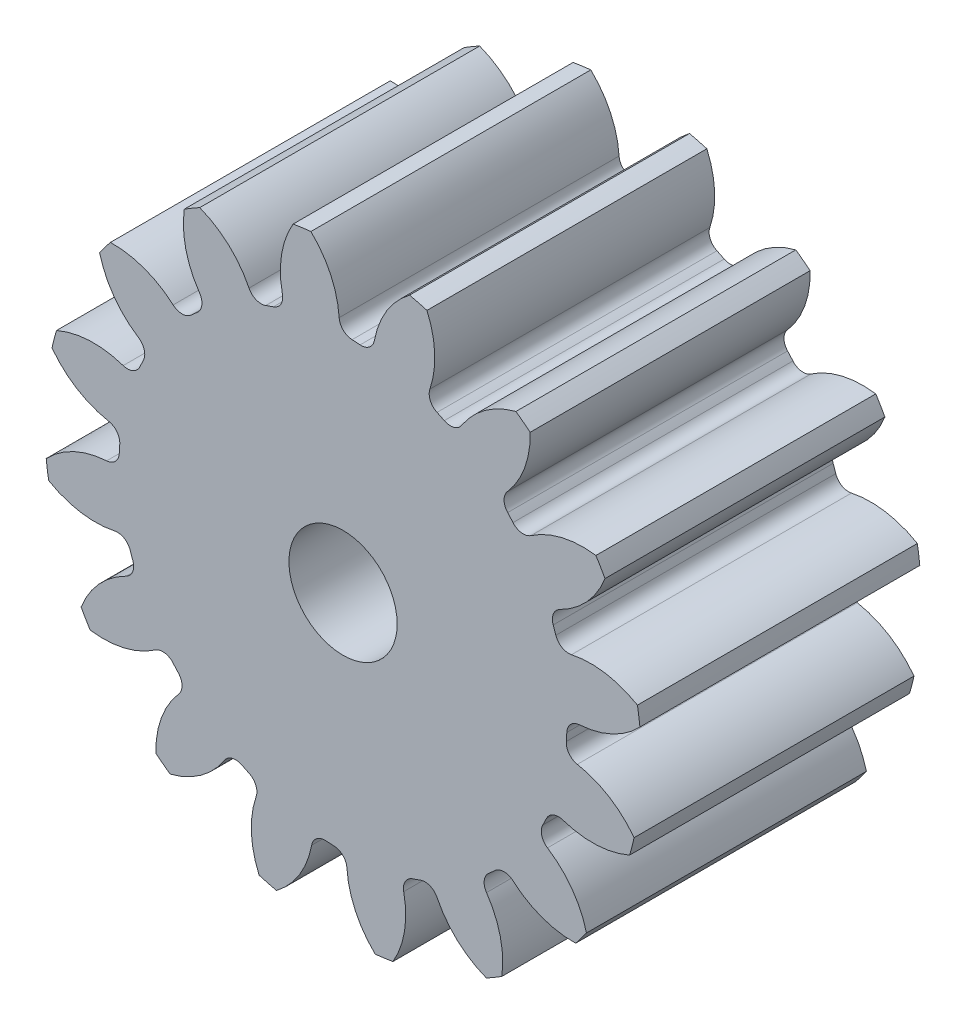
SolidWorks part; units mm, degrees
ref_plane "Front" through (0, 0, 0) normal (0, 0, 1) x (1, 0, 0)
ref_plane "Top" through (0, 0, 0) normal (0, 1, 0) x (1, 0, 0)
ref_plane "Right" through (0, 0, 0) normal (1, 0, 0) x (0, 0, -1)
sketch "Sketch3" plane through (0, 0, 0) normal (0, 0, 1) x (1, 0, 0)
  circle A0 centre (0, 0) radius 101.6
  dimension "od" = 203.2
extrude "gearBody" add sketch "Sketch3" along normal blind 95.25
sketch "Sketch2" plane through (0, 0, 0) normal (0, 0, 1) x (1, 0, 0)
  line L0 (0, 0) -> (78.4047, 32.4763) construction
  line L1 (99.5583, -23.3383) -> (0, 0) construction
  line L2 (0, 0) -> (36.3143, 0) construction
  line L3 (90.24, 3.5827) -> (89.2073, -14.077) construction
  line L5 (89.7236, -5.2472) -> (0, 0) construction
  line L7 (0, 0) -> (84.8647, 0) construction
  arc A0 (84.8429, 1.9236) -> (84.0403, -11.8002) centre (0, 0) ccw construction
  arc A1 (101.0096, 10.9371) -> (99.0461, -22.6367) centre (0, 0) ccw construction
  arc A2 (90.24, 3.5827) -> (89.2073, -14.077) centre (0, 0) ccw construction
  arc A3 (75.9778, -5.8153) -> (76.1377, -3.0807) centre (0, 0) ccw
  arc A4 (99.5583, -23.3383) -> (79.7285, -10.6848) centre (74.0847, -41.3941) ccw
  arc A5 (99.5583, -23.3383) -> (101.6, 11.5743) centre (0, 0) ccw
  arc A6 (101.6, 11.5743) -> (80.4304, 1.3185) centre (78.4047, 32.4763) cw
  arc A7 (76.1377, -3.0807) -> (80.4304, 1.3185) centre (80.7285, -3.2664) cw
  arc A8 (79.7285, -10.6848) -> (75.9778, -5.8153) centre (80.559, -6.1659) cw
  point P6 (101.6, 11.5743)
  point P22 (99.5583, -23.3383)
  dimension "baseDia" = 169.7294
  dimension "od" = 203.2
  dimension "pd" = 180.6222
  dimension "rd" = 152.4
  dimension "rFillet" = 4.5946
  dimension "pointX" = 101.6
  dimension "pointY" = 11.5743
  dimension "CTT" = 17.6597
  dimension "flankCenterAngle" = 22.5
extrude "toothCut" cut sketch "Sketch2" along normal through all
pattern_circular "CirPattern1" count 16 over 360 about axis through (0, 0, 0) along (0, 0, 1) of "toothCut"
sketch "hub1Dia" plane through (0, 0, 0) normal (0, 0, -1) x (-1, 0, 0)
  circle A0 centre (0, 0) radius 12.7
  dimension "hub1Dia" = 25.4
sketch "hub2Dia" plane through (0, 0, 95.25) normal (0, 0, 1) x (1, 0, 0)
  circle A0 centre (0, 0) radius 12.7
  dimension "hub2dia" = 25.4
sketch "boreDia" plane through (0, 0, 0) normal (0, 0, 1) x (1, 0, 0)
  circle A0 centre (0, 0) radius 18.415
  dimension "boreDia" = 36.83
extrude "bore" cut sketch "boreDia" against normal mid plane 25400
